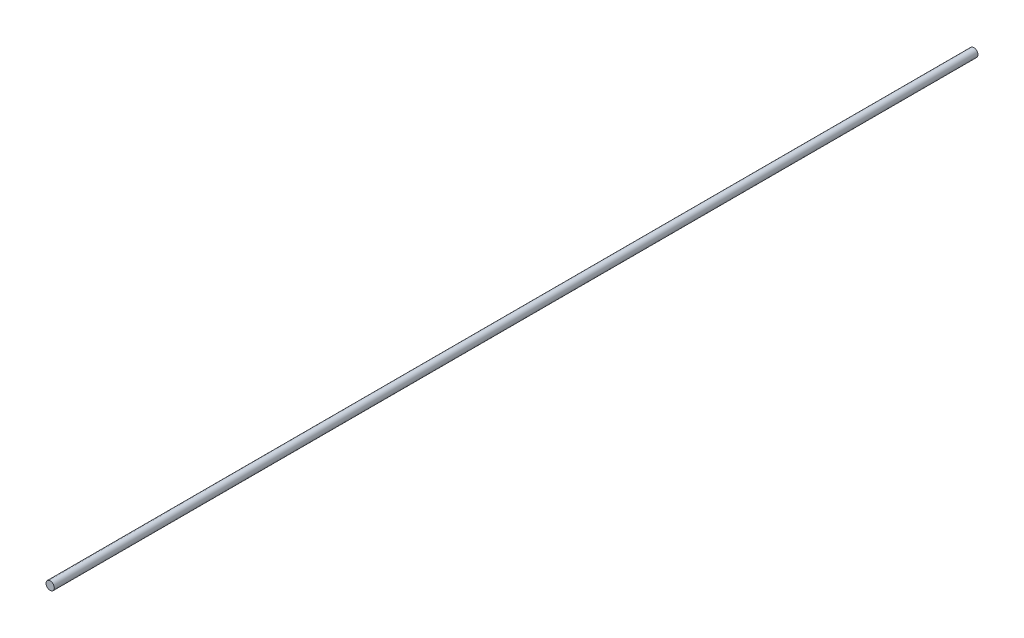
SolidWorks part; units mm, degrees
ref_plane "Face" through (0, 0, 0) normal (0, 0, 1) x (1, 0, 0)
ref_plane "Dessus" through (0, 0, 0) normal (0, 1, 0) x (1, 0, 0)
ref_plane "Droite" through (0, 0, 0) normal (1, 0, 0) x (0, 0, -1)
sketch "Esquisse1" plane through (0, 0, 0) normal (0, 0, 1) x (1, 0, 0)
  circle A0 centre (0, 0) radius 9
  dimension "D1" = 18
extrude "Extrusion1" add sketch "Esquisse1" along normal blind 2000
